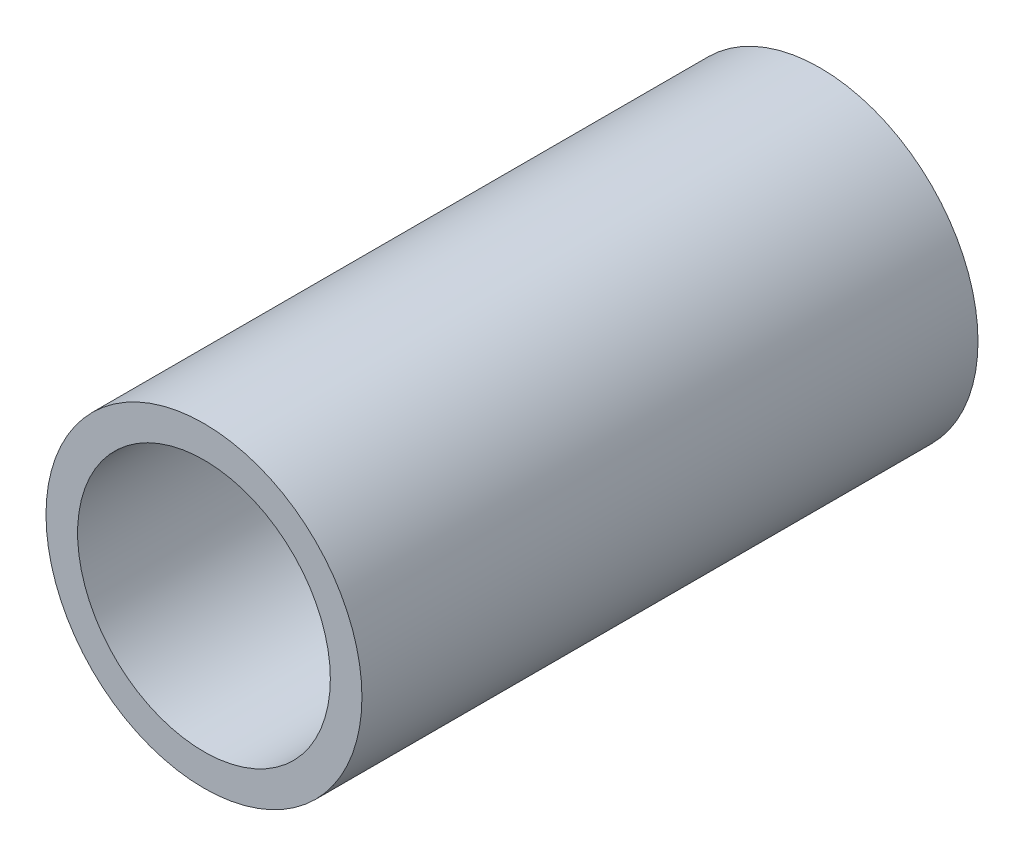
SolidWorks part; units mm, degrees
ref_plane "Спереди" through (0, 0, 0) normal (0, 0, 1) x (1, 0, 0)
ref_plane "Сверху" through (0, 0, 0) normal (0, 1, 0) x (1, 0, 0)
ref_plane "Справа" through (0, 0, 0) normal (1, 0, 0) x (0, 0, -1)
sketch "Эскиз1" plane through (0, 0, 0) normal (0, 0, 1) x (1, 0, 0)
  circle A0 centre (0, 0) radius 4
  circle A1 centre (0, 0) radius 5
  dimension "D1" = 8
  dimension "D2" = 10
extrude "Бобышка-Вытянуть1" add sketch "Эскиз1" along normal blind 19.5
